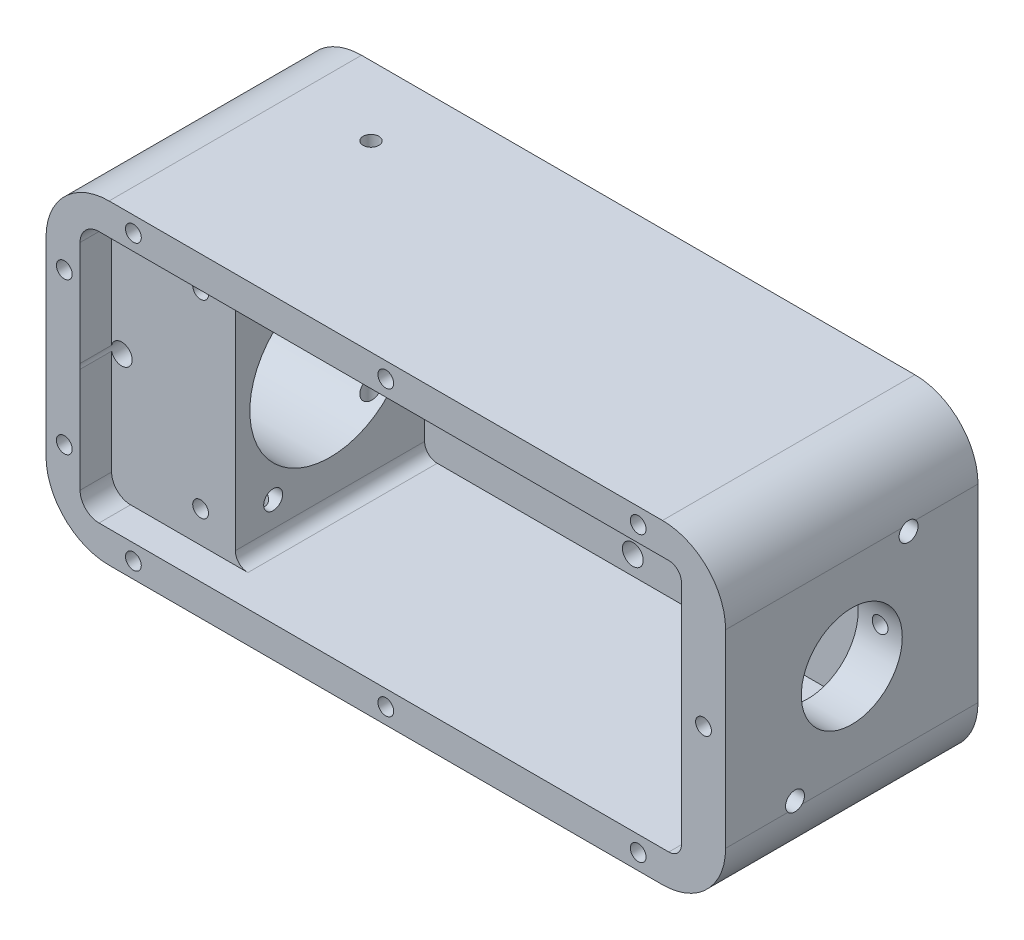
SolidWorks part; units mm, degrees
ref_plane "Front Plane" through (0, 0, 0) normal (0, 0, 1) x (1, 0, 0)
ref_plane "Top Plane" through (0, 0, 0) normal (0, 1, 0) x (1, 0, 0)
ref_plane "Right Plane" through (0, 0, 0) normal (1, 0, 0) x (0, 0, -1)
ref_plane "Plane1" through (0, 0, 40) normal (0, 0, 1) x (1, 0, 0)
sketch "Sketch1" plane through (0, 0, 40) normal (0, 0, 1) x (1, 0, 0)
  line L0 (0, 0) -> (0, -50)
  line L1 (0, -50) -> (107.7, -50)
  line L2 (107.7, -50) -> (107.7, 0)
  line L3 (107.7, 0) -> (0, 0)
extrude "Boss-Extrude1" add sketch "Sketch1" against normal blind 40
sketch "Sketch2" plane through (0, 0, 40) normal (0, 0, 1) x (1, 0, 0)
  line L0 (100.7, -5) -> (25, -5)
  line L1 (25, -5) -> (25, -45)
  line L2 (25, -45) -> (100.7, -45)
  line L3 (100.7, -45) -> (100.7, -5)
extrude "Cut-Extrude1" cut sketch "Sketch2" against normal blind 35
ref_plane "Plane2" through (0, 0, 35) normal (0, 0, -1) x (-1, 0, 0)
sketch "Sketch4" plane through (0, 0, 35) normal (0, 0, -1) x (-1, 0, 0)
  line L0 (-5.4, -45) -> (-5.4, -5)
  line L1 (-5.4, -5) -> (-25, -5)
  line L2 (-25, -5) -> (-25, -45)
  line L3 (-25, -45) -> (-5.4, -45)
extrude "Cut-Extrude2" cut sketch "Sketch4" against normal up to surface
sketch "Sketch5" plane through (0, 0, 0) normal (0, 0, -1) x (-1, 0, 0)
  line L0 (-99.7, -19.85) -> (-99.7, -30.15)
  line L1 (-99.7, -30.15) -> (-54.7, -30.15)
  line L2 (-54.7, -30.15) -> (-54.7, -19.85)
  line L3 (-54.7, -19.85) -> (-99.7, -19.85)
extrude "Cut-Extrude3" cut sketch "Sketch5" against normal through all
hole_wizard "#4 Clearance Hole1" positions "Sketch7" profile "Sketch6" hole size "#4" standard "ANSI Inch"
sketch "Sketch7" plane through (0, 0, 0) normal (0, 0, -1) x (-1, 0, 0)
  point P0 (-58, -42)
  point P1 (-78, -42)
  point P2 (-98, -42)
  point P3 (-98, -8)
  point P4 (-58, -8)
  point P5 (-78, -8)
sketch "Sketch6" plane through (58, -42, 0) normal (1, 0, 0) x (0, 1, 0)
  line L0 (0, 0) -> (0, 40)
  line L1 (0, 40) -> (1.65, 40)
  line L2 (1.65, 40) -> (1.65, 0)
  line L5 (1.65, 0) -> (0, 0)
  line L11 (0, -6.35) -> (0, 107.95) construction
  dimension "Thru Hole Dia." = 3.3
  dimension "Thru Hole Depth" = 40
hole_wizard "#4 Clearance Hole2" positions "Sketch9" profile "Sketch8" hole size "#4" standard "ANSI Inch"
sketch "Sketch9" plane through (0, 0, 0) normal (0, 0, -1) x (-1, 0, 0)
  point P0 (-8, -8)
sketch "Sketch8" plane through (8, -8, 0) normal (1, 0, 0) x (0, 1, 0)
  line L0 (0, 0) -> (0, 10)
  line L1 (0, 10) -> (1.65, 10)
  line L2 (1.65, 10) -> (1.65, 0)
  line L5 (1.65, 0) -> (0, 0)
  line L10 (0, 10) -> (-1.65, 10) construction
  line L11 (0, -6.35) -> (0, 107.95) construction
  dimension "Hole Dia." = 3.3
  dimension "Hole Depth" = 10
  dimension "Drill Angle" = 180
hole_wizard "#3 Clearance Hole1" positions "Sketch11" profile "Sketch10" hole size "#3" standard "ANSI Inch"
sketch "Sketch11" plane through (107.7, 0, 0) normal (1, 0, 0) x (0, 0, -1)
  point P0 (-29, -39)
sketch "Sketch10" plane through (107.7, -39, 29) normal (0, 1, 0) x (0, 0, -1)
  line L0 (0, 0) -> (0, 7)
  line L1 (0, 7) -> (1.5, 7)
  line L2 (1.5, 7) -> (1.5, 0)
  line L5 (1.5, 0) -> (0, 0)
  line L11 (0, -6.35) -> (0, 107.95) construction
  dimension "Thru Hole Dia." = 3
  dimension "Thru Hole Depth" = 7
hole_wizard "#3 Clearance Hole2" positions "Sketch13" profile "Sketch12" hole size "#3" standard "ANSI Inch"
sketch "Sketch13" plane through (100.7, 0, 0) normal (-1, 0, 0) x (0, 0, 1)
  point P0 (11, -11)
sketch "Sketch12" plane through (100.7, -11, 11) normal (0, 1, 0) x (0, 0, 1)
  line L0 (0, 0) -> (0, 7)
  line L1 (0, 7) -> (1.5, 7)
  line L2 (1.5, 7) -> (1.5, 0)
  line L5 (1.5, 0) -> (0, 0)
  line L11 (0, -6.35) -> (0, 107.95) construction
  dimension "Thru Hole Dia." = 3
  dimension "Thru Hole Depth" = 7
hole_wizard "#2 Clearance Hole1" positions "Sketch15" profile "Sketch14" hole size "#2" standard "ANSI Inch"
sketch "Sketch15" plane through (0, 0, 0) normal (0, 1, 0) x (1, 0, 0)
  point P0 (22.5, -11)
sketch "Sketch14" plane through (22.5, 0, 11) normal (1, 0, 0) x (0, 0, 1)
  line L0 (0, 0) -> (0, 50)
  line L1 (0, 50) -> (1.25, 50)
  line L2 (1.25, 50) -> (1.25, 0)
  line L5 (1.25, 0) -> (0, 0)
  line L11 (0, -6.35) -> (0, 107.95) construction
  dimension "Thru Hole Dia." = 2.5
  dimension "Thru Hole Depth" = 50
hole_wizard "Hole1" positions "Sketch17" profile "Sketch16" legacy
sketch "Sketch17" plane through (107.7, 0, 0) normal (1, 0, 0) x (0, 0, -1)
  point P0 (-20, -25)
sketch "Sketch16" plane through (107.7, -25, 20) normal (0, 1, 0) x (0, 0, -1)
  line L0 (0, 0) -> (0, 7)
  line L1 (0, 7) -> (8, 7)
  line L2 (8, 7) -> (8, 0)
  line L3 (8, 0) -> (0, 0)
  line L4 (0, 110) -> (0, -10) construction
  dimension "Diameter" = 16
  dimension "Depth" = 7
hole_wizard "#2 Clearance Hole2" positions "Sketch19" profile "Sketch18" hole size "#2" standard "ANSI Inch"
sketch "Sketch19" plane through (0, 0, 40) normal (0, 0, 1) x (1, 0, 0)
  point P0 (104.2, -25)
sketch "Sketch18" plane through (104.2, -25, 40) normal (1, 0, 0) x (0, -1, 0)
  line L0 (0, 0) -> (0, 52.0983)
  line L1 (0, 52.0983) -> (1.25, 52.0983)
  line L2 (1.25, 52.0983) -> (1.25, 0)
  line L5 (1.25, 0) -> (0, 0)
  line L10 (0, 52.0983) -> (-1.25, 52.0983) construction
  line L11 (0, -6.35) -> (0, 107.95) construction
  dimension "Hole Dia." = 2.5
  dimension "Hole Depth" = 52.0983
  dimension "Drill Angle" = 180
hole_wizard "#3 Clearance Hole3" positions "Sketch21" profile "Sketch20" hole size "#3" standard "ANSI Inch"
sketch "Sketch21" plane through (0, 0, 0) normal (-1, 0, 0) x (0, 0, 1)
  point P0 (29, -39)
  point P1 (11, -11)
sketch "Sketch20" plane through (0, -39, 29) normal (0, 1, 0) x (0, 0, 1)
  line L0 (0, 0) -> (0, 107.7)
  line L1 (0, 107.7) -> (1.5, 107.7)
  line L2 (1.5, 107.7) -> (1.5, 0)
  line L5 (1.5, 0) -> (0, 0)
  line L11 (0, -6.35) -> (0, 107.95) construction
  dimension "Thru Hole Dia." = 3
  dimension "Thru Hole Depth" = 107.7
hole_wizard "#2 Clearance Hole3" positions "Sketch23" profile "Sketch22" hole size "#2" standard "ANSI Inch"
sketch "Sketch23" plane through (0, 0, 40) normal (0, 0, 1) x (1, 0, 0)
  point P0 (2.9, -37)
  point P1 (93.85, -2.5)
  point P2 (53.85, -2.5)
  point P3 (13.85, -2.5)
  point P4 (2.9, -13)
  point P5 (13.85, -47.5)
  point P6 (53.85, -47.5)
  point P7 (93.85, -47.5)
sketch "Sketch22" plane through (2.9, -37, 40) normal (1, 0, 0) x (0, -1, 0)
  line L0 (0, 0) -> (0, 10)
  line L1 (0, 10) -> (1.25, 10)
  line L2 (1.25, 10) -> (1.25, 0)
  line L5 (1.25, 0) -> (0, 0)
  line L10 (0, 10) -> (-1.25, 10) construction
  line L11 (0, -6.35) -> (0, 107.95) construction
  dimension "Hole Dia." = 2.5
  dimension "Hole Depth" = 10
  dimension "Drill Angle" = 180
hole_wizard "#2 Clearance Hole4" positions "Sketch25" profile "Sketch24" hole size "#2" standard "ANSI Inch"
sketch "Sketch25" plane through (0, -50, 0) normal (0, -1, 0) x (-1, 0, 0)
  point P0 (-22.5, -29)
sketch "Sketch24" plane through (22.5, -50, 29) normal (1, 0, 0) x (0, 0, -1)
  line L0 (0, 0) -> (0, 9.5)
  line L1 (0, 9.5) -> (1.25, 9.5)
  line L2 (1.25, 9.5) -> (1.25, 0)
  line L5 (1.25, 0) -> (0, 0)
  line L11 (0, -6.35) -> (0, 107.95) construction
  dimension "Thru Hole Dia." = 2.5
  dimension "Thru Hole Depth" = 9.5
hole_wizard "1 (1) Diameter Hole1" positions "Sketch27" profile "Sketch26" hole size "1" standard "ANSI Inch"
sketch "Sketch27" plane through (25, 0, 0) normal (1, 0, 0) x (0, 0, -1)
  point P0 (-20, -25)
sketch "Sketch26" plane through (25, -25, 20) normal (0, 1, 0) x (0, 0, -1)
  line L0 (0, 0) -> (0, 25)
  line L1 (0, 25) -> (12.7, 25)
  line L2 (12.7, 25) -> (12.7, 0)
  line L5 (12.7, 0) -> (0, 0)
  line L11 (0, -6.35) -> (0, 107.95) construction
  dimension "Thru Hole Dia." = 25.4
  dimension "Thru Hole Depth" = 25
ref_plane "Plane3" through (0, 0, 32.5924) normal (0, 0, -1) x (-1, 0, 0)
hole_wizard "#4 Clearance Hole3" positions "Sketch29" profile "Sketch28" hole size "#4" standard "ANSI Inch"
sketch "Sketch29" plane through (0, 0, 32.5924) normal (0, 0, -1) x (-1, 0, 0)
  point P0 (-7, -25)
sketch "Sketch28" plane through (7, -25, 32.5924) normal (1, 0, 0) x (0, 1, 0)
  line L0 (0, 0) -> (0, 40)
  line L1 (0, 40) -> (1.65, 40)
  line L2 (1.65, 40) -> (1.65, 0)
  line L5 (1.65, 0) -> (0, 0)
  line L10 (0, 40) -> (-1.65, 40) construction
  line L11 (0, -6.35) -> (0, 107.95) construction
  dimension "Hole Dia." = 3.3
  dimension "Hole Depth" = 40
  dimension "Drill Angle" = 180
hole_wizard "#2 Clearance Hole5" positions "Sketch31" profile "Sketch30" hole size "#2" standard "ANSI Inch"
sketch "Sketch31" plane through (0, 0, 35) normal (0, 0, 1) x (1, 0, 0)
  point P0 (19.5, -10)
  point P1 (19.5, -40)
sketch "Sketch30" plane through (19.5, -10, 35) normal (1, 0, 0) x (0, -1, 0)
  line L0 (0, 0) -> (0, 10)
  line L1 (0, 10) -> (1.25, 10)
  line L2 (1.25, 10) -> (1.25, 0)
  line L5 (1.25, 0) -> (0, 0)
  line L10 (0, 10) -> (-1.25, 10) construction
  line L11 (0, -6.35) -> (0, 107.95) construction
  dimension "Hole Dia." = 2.5
  dimension "Hole Depth" = 10
  dimension "Drill Angle" = 180
fillet "Fillet1" radius 2 8 edges at (54.7, -19.85, 2.5) (54.7, -30.15, 2.5) (25, -45, 20) (100.7, -5, 22.5) (99.7, -30.15, 2.5) (100.7, -45, 22.5) (25, -5, 20) (99.7, -19.85, 2.5)
fillet "Fillet2" radius 3 2 edges at (5.4, -5, 37.5) (5.4, -45, 37.5)
fillet "Fillet3" radius 10 4 edges at (107.7, 0, 20) (107.7, -50, 20) (0, 0, 20) (0, -50, 20)
